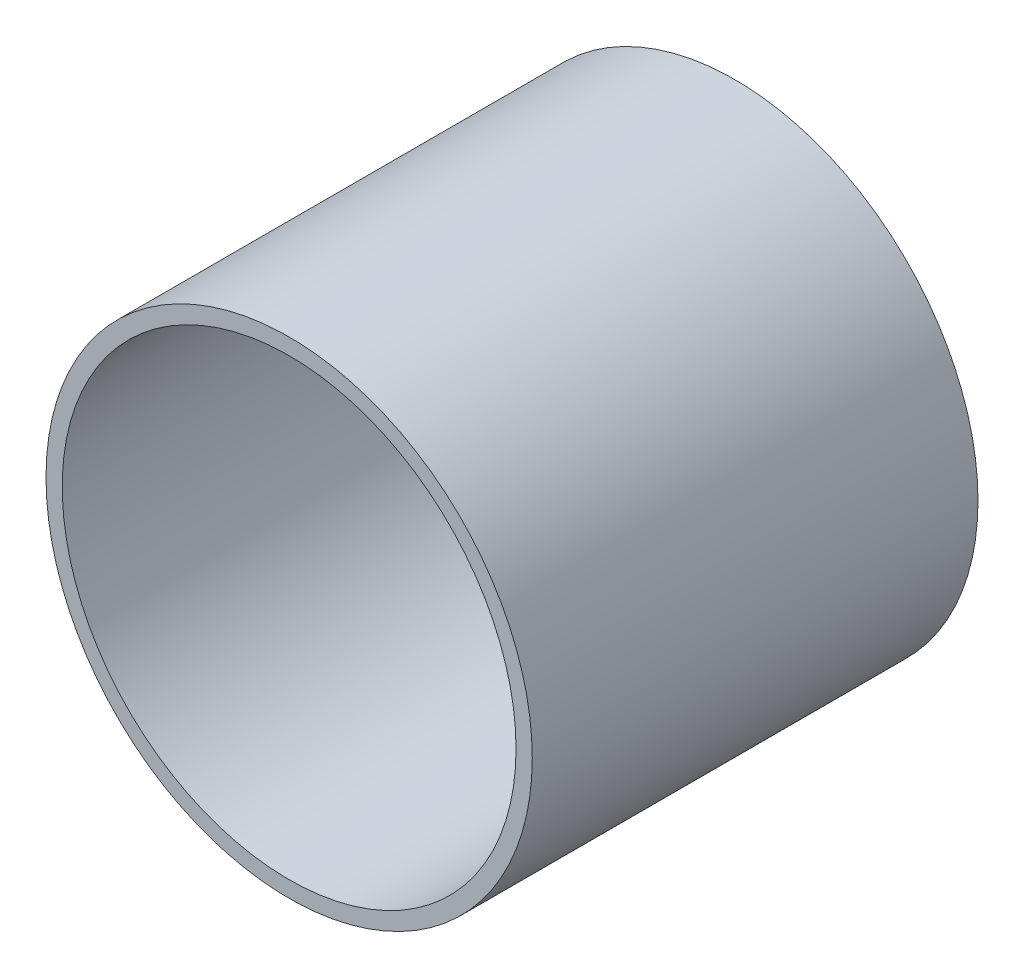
SolidWorks part; units mm, degrees
ref_plane "Plan de face" through (0, 0, 0) normal (0, 0, 1) x (1, 0, 0)
ref_plane "Plan de dessus" through (0, 0, 0) normal (0, 1, 0) x (1, 0, 0)
ref_plane "Plan de droite" through (0, 0, 0) normal (1, 0, 0) x (0, 0, -1)
sketch "Esquisse1" plane through (0, 0, 0) normal (0, 0, 1) x (1, 0, 0)
  circle A0 centre (0, 0) radius 3
  circle A1 centre (0, 0) radius 2.8
  dimension "D1" = 6
  dimension "D2" = 0.2
extrude "Bushing" add sketch "Esquisse1" along normal blind 5.5
